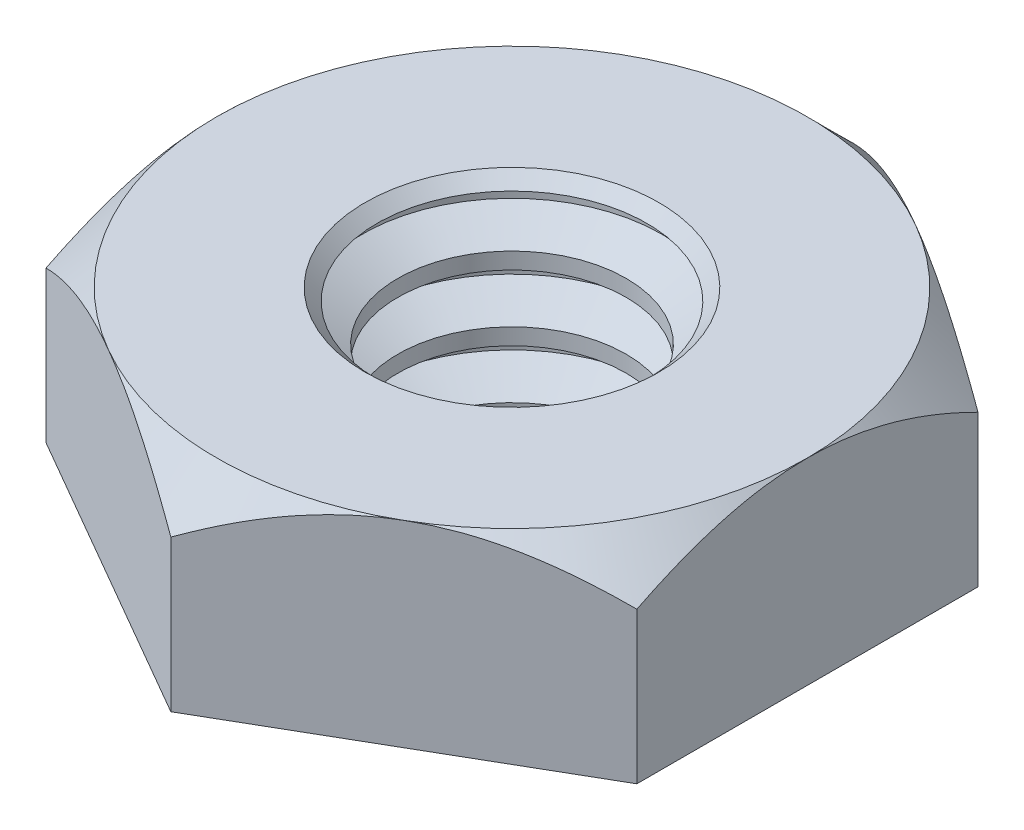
SolidWorks part; units mm, degrees
ref_plane "Front" through (0, 0, 0) normal (0, 0, 1) x (1, 0, 0)
ref_plane "Top" through (0, 0, 0) normal (0, 1, 0) x (1, 0, 0)
ref_plane "Right" through (0, 0, 0) normal (1, 0, 0) x (0, 0, -1)
sketch "Sketch1" plane through (0, 0, 0) normal (0, 1, 0) x (1, 0, 0)
  line L1 (0, 5.4993) -> (-4.7625, 2.7496)
  line L2 (-4.7625, 2.7496) -> (-4.7625, -2.7496)
  line L3 (-4.7625, -2.7496) -> (0, -5.4993)
  line L4 (0, -5.4993) -> (4.7625, -2.7496)
  line L5 (4.7625, -2.7496) -> (4.7625, 2.7496)
  line L6 (4.7625, 2.7496) -> (0, 5.4993)
  circle A0 centre (0, 0) radius 4.7625 construction
  dimension "Hex Flats" = 9.525
extrude "Extrude1" add sketch "Sketch1" along normal blind 3.175
sketch "Sketch3" plane through (0, 0, 0) normal (1, 0, 0) x (0, 0, -1)
  line L0 (4.7625, 3.175) -> (5.4993, 2.4382)
  line L1 (2.7496, 3.175) -> (5.4993, 3.175) construction
  line L2 (5.4993, 3.175) -> (5.4993, 0) construction
  line L3 (5.4993, 2.4382) -> (5.4993, 3.175)
  line L4 (5.4993, 3.175) -> (4.7625, 3.175)
  line L5 (0, 0.542) -> (0, -0.542) construction
  dimension "D1" = 45
  dimension "D2" = 9.525
revolve "Cut-Revolve2" cut sketch "Sketch3" angle 360 about L5
sketch "Sketch2" plane through (0, 0, 0) normal (0, 0, 1) x (1, 0, 0)
  line L0 (0, 1.6636) -> (0, -0.3796) construction
  line L1 (0, 3.175) -> (1.8402, 3.175)
  line L3 (0, 3.175) -> (4.7625, 3.175) construction
  line L4 (0, 2.1167) -> (1.8402, 2.1167)
  line L5 (1.8402, 3.175) -> (2.413, 2.8443)
  line L6 (2.413, 2.8443) -> (2.413, 2.712)
  line L7 (2.413, 2.712) -> (1.8402, 2.3813)
  line L9 (1.8402, 2.1167) -> (1.8402, 2.3813)
  line L10 (0, 2.1167) -> (0, 3.175)
  line L11 (1.8402, 3.175) -> (1.8402, 2.3813) construction
  line L12 (2.413, 2.7781) -> (1.8402, 2.7781) construction
  dimension "D1" = 60
  dimension "D2" = 0.2646
  dimension "D5" = 0.1323
  dimension "Pitch" = 1.0583
  dimension "Major Dia." = 4.826
revolve "Cut-Revolve1" cut sketch "Sketch2" angle 360 about L0
pattern_linear "LPattern2" count 4 spacing 1.0583 along (0, -1, 0)
chamfer "Chamfer1" distance 0.5292 angle 45
equation "\"D5@Sketch2\"=\"Pitch@Sketch2\"/8"
equation "\"D2@Sketch2\"=\"Pitch@Sketch2\"/4"
equation "\"D3@LPattern2\"=\"Pitch@Sketch2\""
equation "\"D1@LPattern2\"=int(\"Height@Extrude1\"/\"Pitch@Sketch2\")+1"
equation "\"D2@Sketch3\"=\"Hex Flats@Sketch1\""
equation "\"D1@Chamfer1\"=\"Pitch@Sketch2\"/2"
